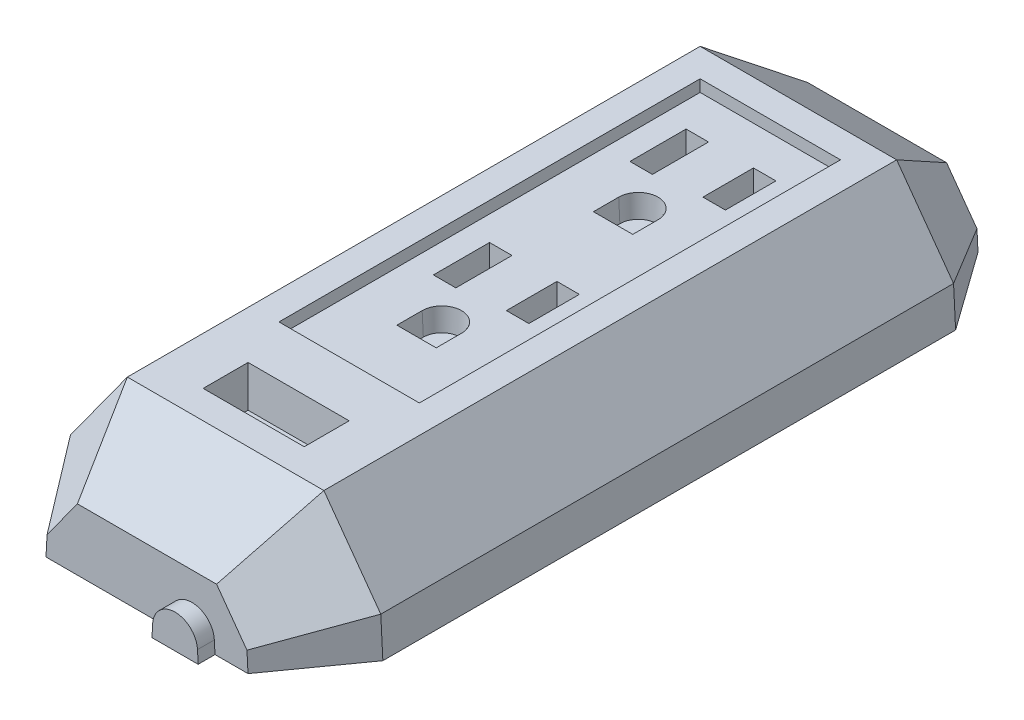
SolidWorks part; units mm, degrees
ref_plane "Front Plane" through (0, 0, 0) normal (0, 0, 1) x (1, 0, 0)
ref_plane "Top Plane" through (0, 0, 0) normal (0, 1, 0) x (1, 0, 0)
ref_plane "Right Plane" through (0, 0, 0) normal (1, 0, 0) x (0, 0, -1)
sketch "Sketch1" plane through (0, 0, 0) normal (0, 0, 1) x (1, 0, 0)
  line L0 (17.5, 21) -> (27.6331, 7)
  line L1 (-17.5, 21) -> (17.5, 21)
  line L2 (-27.6331, 7) -> (-28, 0)
  line L3 (-28, 0) -> (28, 0)
  line L4 (27.6331, 7) -> (28, 0)
  line L5 (-27.6331, 7) -> (-17.5, 21)
  line L6 (0, 0) -> (0, 21) construction
  dimension "D1" = 56
  dimension "D2" = 35
  dimension "D3" = 21
  dimension "D4" = 7
  dimension "D5" = 3
extrude "Extrude1" add sketch "Sketch1" along normal blind 130
chamfer "Chamfer1" distance 14 distance2 10 5 edges at (27.8166, 3.5, 130) (22.5666, 14, 130) (0, 21, 130) (-22.5666, 14, 130) (-27.8166, 3.5, 130)
chamfer "Chamfer2" distance 10 distance2 14 5 edges at (-27.8166, 3.5, 0) (-22.5666, 14, 0) (0, 21, 0) (22.5666, 14, 0) (27.8166, 3.5, 0)
sketch "Sketch2" plane through (5.7452, -1.8948, 130) normal (0, 0, 1) x (1, 0, 0)
  line L1 (-23.7315, 1.8948) -> (12.2411, 1.8948) construction
  line L2 (-1.8555, 1.8948) -> (6.3651, 1.8948)
  line L3 (-1.8555, 1.8948) -> (-1.7397, 4.1042)
  line L4 (6.3651, 1.8948) -> (6.2493, 4.1042)
  line L5 (2.2548, 1.8948) -> (2.2548, 3.8948) construction
  arc A0 (6.2493, 4.1042) -> (-1.7397, 4.1042) centre (2.2548, 3.8948) ccw
  circle A1 centre (2.2548, 3.8948) radius 2 construction
  dimension "D1" = 4
  dimension "D3" = 6
  dimension "D5" = 4
  dimension "D2" = 3
  dimension "D4" = 8
extrude "Extrude2" add sketch "Sketch2" along normal blind 3
sketch "Sketch3" plane through (3.4925, 21, 107.5782) normal (0, 1, 0) x (1, 0, 0)
  line L1 (9.0075, 88.5782) -> (-15.9925, 88.5782)
  line L2 (9.0075, 88.5782) -> (9.0075, 13.5782)
  line L3 (9.0075, 13.5782) -> (-15.9925, 13.5782)
  line L4 (-15.9925, 88.5782) -> (-15.9925, 13.5782)
  line L7 (14.0075, 93.5782) -> (-20.9925, 93.5782) construction
  line L8 (-20.9925, -8.4218) -> (-20.9925, 93.5782) construction
  line L9 (14.0075, -8.4218) -> (14.0075, 93.5782) construction
  dimension "D1" = 5
  dimension "D2" = 5
  dimension "D3" = 5
  dimension "D4" = 80
extrude "Cut-Extrude1" cut sketch "Sketch3" against normal blind 2 draft 3
sketch "Sketch4" plane through (-3.0826, 19, 40.4689) normal (0, 1, 0) x (-1, 0, 0)
  line L0 (-20.5826, -26.4689) -> (14.4174, -26.4689) construction
  line L3 (0.9174, -14.4689) -> (-7.0826, -14.4689) construction
  line L4 (-3.0826, 2.0311) -> (-3.0826, -14.4689) construction
  line L9 (-7.0826, -14.4689) -> (-7.0826, -5.4689)
  line L10 (-11.0826, -14.4689) -> (-7.0826, -14.4689)
  line L11 (-11.0826, -5.4689) -> (-11.0826, -14.4689)
  line L12 (-7.0826, -5.4689) -> (-11.0826, -5.4689)
  line L18 (4.9174, -14.4689) -> (4.9174, -4.4689)
  line L19 (0.9174, -14.4689) -> (4.9174, -14.4689)
  line L20 (0.9174, -4.4689) -> (0.9174, -14.4689)
  line L21 (4.9174, -4.4689) -> (0.9174, -4.4689)
  line L25 (-6.5826, 6.5311) -> (-6.5826, 2.0311)
  line L26 (0.4174, 6.5311) -> (-6.5826, 6.5311)
  line L27 (0.4174, 2.0311) -> (0.4174, 6.5311)
  arc A2 (-6.5826, 2.0311) -> (0.4174, 2.0311) centre (-3.0826, 2.0311) ccw
  dimension "D1" = 21
  dimension "D2" = 4
  dimension "D3" = 8
  dimension "D4" = 10
  dimension "D5" = 9
  dimension "D6" = 7
  dimension "D7" = 4.5
  dimension "D8" = 12
extrude "Cut-Extrude2" cut sketch "Sketch4" against normal blind 4 draft 3
pattern_linear "LPattern1" count 2 spacing 35 along (0, 0, 1) of "Cut-Extrude2"
sketch "Sketch5" plane through (0.7926, 21, 213.5131) normal (0, 1, 0) x (1, 0, 0)
  line L0 (-0.7926, 102.5131) -> (-0.7926, 110.5131) construction
  line L1 (-9.7926, 102.5131) -> (8.2074, 102.5131)
  line L2 (-9.7926, 102.5131) -> (-9.7926, 110.5131)
  line L3 (-9.7926, 110.5131) -> (8.2074, 110.5131)
  line L4 (8.2074, 102.5131) -> (8.2074, 110.5131)
  line L7 (-18.2926, 97.5131) -> (16.7074, 97.5131) construction
  line L8 (-0.7926, 163.5131) -> (-0.7926, 263.5131) construction
  dimension "D1" = 5
  dimension "D2" = 8
  dimension "D3" = 18
extrude "Cut-Extrude3" cut sketch "Sketch5" against normal blind 7 draft 3
